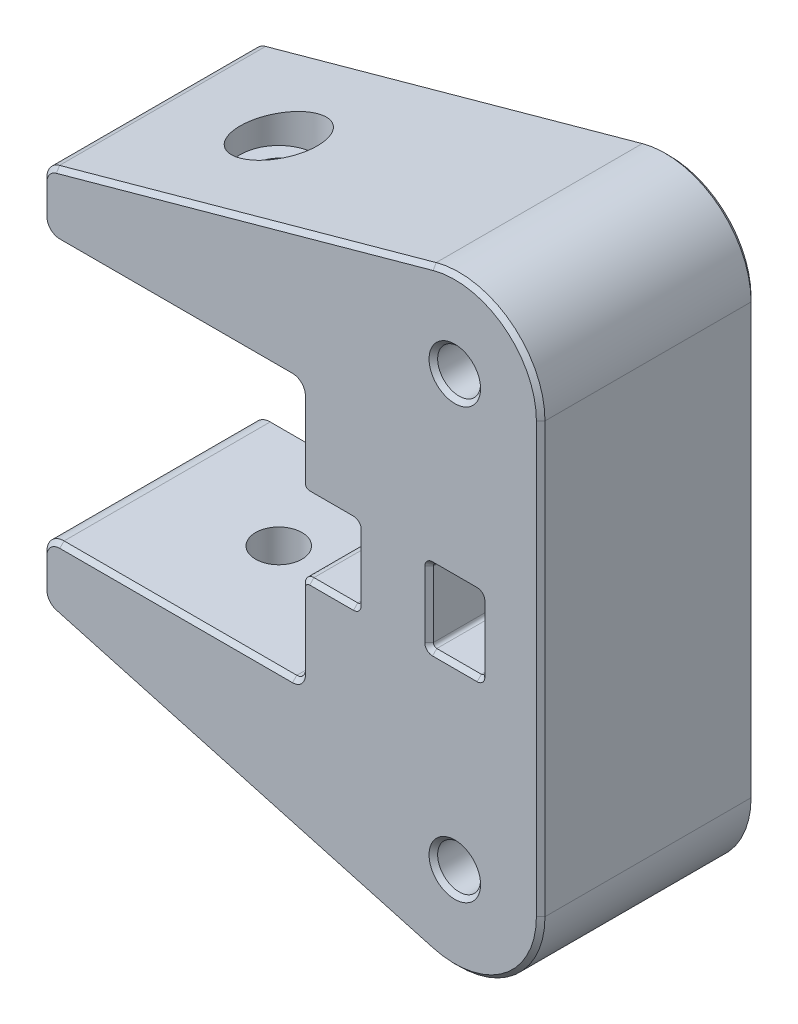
SolidWorks part; units mm, degrees
ref_plane "Płaszczyzna przednia" through (0, 0, 0) normal (0, 0, 1) x (1, 0, 0)
ref_plane "Płaszczyzna górna" through (0, 0, 0) normal (0, 1, 0) x (1, 0, 0)
ref_plane "Płaszczyzna prawa" through (0, 0, 0) normal (1, 0, 0) x (0, 0, -1)
sketch "Szkic1" plane through (0, 0, 0) normal (0, 0, 1) x (1, 0, 0)
  line L0 (0, 30.1) -> (0, 37.1)
  line L1 (0, 0) -> (30, 0) construction
  line L2 (0, 0) -> (0, 30) construction
  line L3 (0, 30) -> (30, 30) construction
  line L4 (30, 0) -> (30, 30) construction
  line L5 (0, 37.1) -> (45.3344, 49.6382)
  line L6 (0, 30.1) -> (30.1, 30.1)
  line L7 (30.1, 30.1) -> (30.1, -0.1)
  line L8 (30.1, -0.1) -> (0, -0.1)
  line L9 (0, -0.1) -> (0, -7.1)
  line L10 (0, -7.1) -> (45.3344, -19.6382)
  line L11 (48, 40) -> (48, -10) construction
  line L12 (58, 40) -> (58, -10)
  line L13 (43.3812, 40) -> (45.6906, 36)
  line L14 (45.6906, 36) -> (50.3094, 36)
  line L15 (50.3094, 36) -> (52.6188, 40)
  line L16 (52.6188, 40) -> (50.3094, 44)
  line L17 (50.3094, 44) -> (45.6906, 44)
  line L18 (45.6906, 44) -> (43.3812, 40)
  line L19 (52.6188, -10) -> (50.3094, -6)
  line L20 (50.3094, -6) -> (45.6906, -6)
  line L21 (45.6906, -6) -> (43.3812, -10)
  line L22 (43.3812, -10) -> (45.6906, -14)
  line L23 (45.6906, -14) -> (50.3094, -14)
  line L24 (50.3094, -14) -> (52.6188, -10)
  circle A2 centre (48, 40) radius 4 construction
  circle A3 centre (48, -10) radius 4 construction
  arc A4 (58, 40) -> (45.3344, 49.6382) centre (48, 40) ccw
  arc A5 (45.3344, -19.6382) -> (58, -10) centre (48, -10) ccw
  point P15 (30, 15)
  point P16 (48, 15)
  dimension "D6" = 8
  dimension "D7" = 20
  dimension "D1" = 30
  dimension "D2" = 50
  dimension "D3" = 0.1
  dimension "D4" = 0.1
  dimension "D5" = 18
  dimension "D8" = 0.1
  dimension "D9" = 7
extrude "Dodanie-wyciągnięcie1" add sketch "Szkic1" along normal blind 21
sketch "Szkic3" plane through (0, 0, 21) normal (0, 0, 1) x (1, 0, 0)
  line L8 (0, 30.1) -> (30.1, 30.1)
  line L9 (30.1, 30.1) -> (30.1, -0.1)
  line L10 (30.1, -0.1) -> (0, -0.1)
  line L11 (0, -0.1) -> (0, -7.1)
  line L12 (0, -7.1) -> (45.3344, -19.6382)
  line L13 (58, -10) -> (58, 40)
  line L14 (45.3344, 49.6382) -> (0, 37.1)
  line L15 (0, 37.1) -> (0, 30.1)
  line L16 (0, 30.1) -> (30.1, 30.1)
  line L17 (30.1, 30.1) -> (30.1, -0.1)
  line L18 (30.1, -0.1) -> (0, -0.1)
  line L19 (0, -0.1) -> (0, -7.1)
  line L20 (0, -7.1) -> (45.3344, -19.6382)
  line L21 (58, -10) -> (58, 40)
  line L22 (45.3344, 49.6382) -> (0, 37.1)
  line L23 (0, 37.1) -> (0, 30.1)
  circle A0 centre (48, 40) radius 2.5
  circle A1 centre (48, -10) radius 2.5
  arc A2 (45.3344, -19.6382) -> (58, -10) centre (48, -10) ccw
  arc A3 (58, 40) -> (45.3344, 49.6382) centre (48, 40) ccw
  arc A4 (45.3344, -19.6382) -> (58, -10) centre (48, -10) ccw
  arc A5 (58, 40) -> (45.3344, 49.6382) centre (48, 40) ccw
  dimension "D2" = 5
  dimension "D1" = 0
extrude "Dodanie-wyciągnięcie2" add sketch "Szkic3" along normal blind 4
sketch "Szkic4" plane through (0, -0.1, 0) normal (0, 1, 0) x (1, 0, 0)
  line L0 (0, -12.5) -> (15, -12.5) construction
  line L1 (0, -25) -> (0, 0) construction
  circle A0 centre (15, -12.5) radius 2.7
  dimension "D2" = 5.4
  dimension "D1" = 15
extrude "Wytnij-wyciągnięcie1" cut sketch "Szkic4" against normal through all both and the other way through all
ref_plane "Płaszczyzna1" through (0, 37.1, 0) normal (0, -1, 0) x (-1, 0, 0)
ref_plane "Płaszczyzna2" through (0, -7.1, 0) normal (0, -1, 0) x (-1, 0, 0)
sketch "Szkic7" plane through (0, -7.1, 0) normal (0, -1, 0) x (-1, 0, 0)
  circle A0 centre (-15, -12.5) radius 4.5
  dimension "D1" = 9
extrude "Wytnij-wyciągnięcie4" cut sketch "Szkic7" along normal blind 20
sketch "Szkic8" plane through (0, 37.1, 0) normal (0, -1, 0) x (-1, 0, 0)
  circle A0 centre (-15, -12.5) radius 4.5
  dimension "D1" = 9
extrude "Wytnij-wyciągnięcie5" cut sketch "Szkic8" against normal blind 20
sketch "Szkic9" plane through (0, 0, 0) normal (0, 0, -1) x (-1, 0, 0)
  line L4 (-51, 19.25) -> (-51, 10.75)
  line L5 (-45, 19.25) -> (-51, 19.25)
  line L6 (-51, 10.75) -> (-45, 10.75)
  line L7 (-45, 10.75) -> (-45, 19.25)
  line L11 (-30.1, 10.75) -> (-36.6, 10.75)
  line L12 (-36.6, 19.25) -> (-30.1, 19.25)
  line L13 (-36.6, 19.25) -> (-36.6, 10.75)
  line L14 (-30.1, 30.1) -> (-30.1, -0.1) construction
  line L15 (-30.1, 19.25) -> (-30.1, 10.75)
  point P12 (-30.1, 15)
  point P13 (-36.6, 15)
  point P14 (-45, 15)
  point P15 (-51, 15)
  point P16 (-48, 10.75)
  dimension "D1" = 6.5
  dimension "D2" = 17.9
  dimension "D3" = 8.5
  dimension "D4" = 6
extrude "Wytnij-wyciągnięcie6" cut sketch "Szkic9" against normal through all
fillet "Zaokrąglenie1" radius 2 4 edges at (0, -7.1, 12.5) (0, -0.1, 12.5) (0, 30.1, 12.5) (0, 37.1, 12.5)
fillet "Zaokrąglenie2" radius 0.4 6 edges at (45, 10.75, 12.5) (51, 10.75, 12.5) (45, 19.25, 12.5) (51, 19.25, 12.5) (36.6, 10.75, 12.5) (36.6, 19.25, 12.5)
fillet "Zaokrąglenie3" radius 1 4 edges at (30.1, 19.25, 12.5) (30.1, 10.75, 12.5) (30.1, -0.1, 12.5) (30.1, 30.1, 12.5)
fillet "Zaokrąglenie4" radius 2 12 edges at (43.3812, -10, 10.5) (45.6906, -6, 10.5) (50.3094, -6, 10.5) (52.6188, -10, 10.5) (50.3094, -14, 10.5) (45.6906, -14, 10.5) (50.3094, 36, 10.5) (52.6188, 40, 10.5) (50.3094, 44, 10.5) (45.6906, 44, 10.5) (43.3812, 40, 10.5) (45.6906, 36, 10.5)
chamfer "Sfazowanie1" distance 0.5 angle 45 90 edges at (45.8453, -13.7321, 0) (44.5359, -12, 0) (43.6906, -10, 0) (44.5359, -8, 0) (45.8453, -6.2679, 0) (48, -6, 0) (50.1547, -6.2679, 0) (51.4641, -8, 0) (52.3094, -10, 0) (51.4641, -12, 0) (50.1547, -13.7321, 0) (48, -14, 0) (36.4828, 19.1328, 0) (36.6, 15, 0) (36.4828, 10.8672, 0) (33.65, 10.75, 0) (30.3929, 10.4571, 0) (30.1, 5.325, 0) (29.8071, 0.1929, 0) (15.55, -0.1, 0) (0.5858, -0.6858, 0) (0, -3.839, 0) (0.4084, -6.7892, 0) (23.4006, -13.5719, 0) (54.0557, -17.9579, 0) (58, 15, 0) (54.0557, 47.9579, 0) (23.4006, 43.5719, 0) (0.4084, 36.7892, 0) (0, 33.839, 0) (0.5858, 30.6858, 0) (15.55, 30.1, 0) (29.8071, 29.8071, 0) (30.1, 24.675, 0) (30.3929, 19.5429, 0) (33.65, 19.25, 0) (50.1547, 43.7321, 0) (51.4641, 42, 0) (52.3094, 40, 0) (51.4641, 38, 0) (50.1547, 36.2679, 0) (48, 36, 0) (45.8453, 36.2679, 0) (44.5359, 38, 0) (43.6906, 40, 0) (44.5359, 42, 0) (45.8453, 43.7321, 0) (48, 44, 0) (50.8828, 10.8672, 0) (48, 10.75, 0) (45.1172, 10.8672, 0) (45, 15, 0) (45.1172, 19.1328, 0) (48, 19.25, 0) (50.8828, 19.1328, 0) (51, 15, 0) (50.5, -10, 25) (50.5, 40, 25) (29.8071, 29.8071, 25) (15.55, 30.1, 25) (0.5858, 30.6858, 25) (0, 33.839, 25) (0.4084, 36.7892, 25) (23.4006, 43.5719, 25) (54.0557, 47.9579, 25) (58, 15, 25) (54.0557, -17.9579, 25) (23.4006, -13.5719, 25) (0.4084, -6.7892, 25) (0, -3.839, 25) (0.5858, -0.6858, 25) (15.55, -0.1, 25) (29.8071, 0.1929, 25) (30.1, 5.325, 25) (30.3929, 10.4571, 25) (33.65, 10.75, 25) (36.4828, 10.8672, 25) (36.6, 15, 25) (36.4828, 19.1328, 25) (33.65, 19.25, 25) (30.3929, 19.5429, 25) (30.1, 24.675, 25) (45.1172, 10.8672, 25) (48, 10.75, 25) (50.8828, 10.8672, 25) (51, 15, 25) (50.8828, 19.1328, 25) (48, 19.25, 25) (45.1172, 19.1328, 25) (45, 15, 25)
